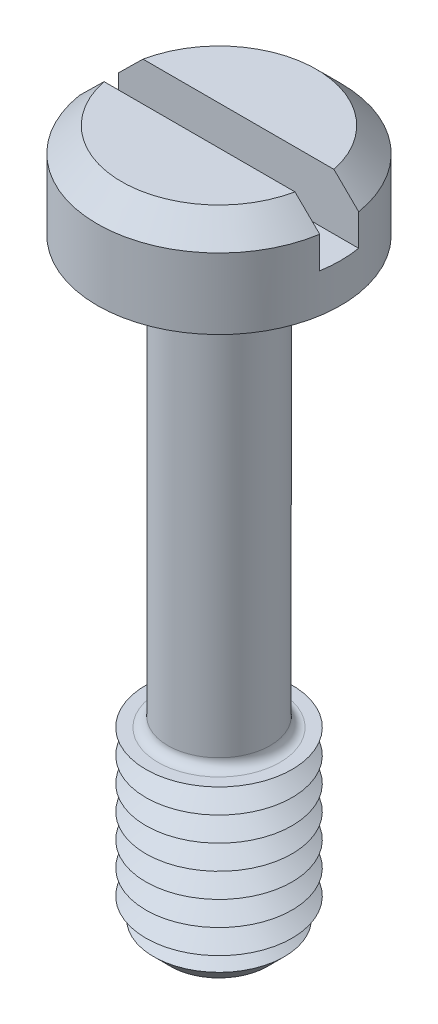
SolidWorks part; units mm, degrees
ref_plane "Front Plane" through (0, 0, 0) normal (0, 0, 1) x (1, 0, 0)
ref_plane "Top Plane" through (0, 0, 0) normal (0, 1, 0) x (1, 0, 0)
ref_plane "Right Plane" through (0, 0, 0) normal (1, 0, 0) x (0, 0, -1)
sketch "Sketch1" plane through (0, 0, 0) normal (0, 1, 0) x (1, 0, 0)
  circle A0 centre (0, 0) radius 5
  dimension "D1" = 10
extrude "Boss-Extrude1" add sketch "Sketch1" along normal blind 3.9
sketch "Sketch2" plane through (0, 0, 0) normal (0, -1, 0) x (1, 0, 0)
  circle A0 centre (0, 0) radius 2.1
  dimension "D1" = 4.2
extrude "Boss-Extrude2" add sketch "Sketch2" along normal blind 25
sketch "Sketch3" plane through (0, -25, 0) normal (0, -1, 0) x (1, 0, 0)
  circle A0 centre (0, 0) radius 3
  dimension "D1" = 6
extrude "Boss-Extrude3" add sketch "Sketch3" against normal blind 7.5
chamfer "Chamfer1" distance 1 angle 45 1 edges at (0, -25, -3)
sketch "Sketch4" plane through (0, 0, 0) normal (1, 0, 0) x (0, 0, -1)
  line L0 (0, -6.5871) -> (0, -12.0372) construction
sketch "Sketch5" plane through (0, 0, 0) normal (1, 0, 0) x (0, 0, -1)
  line L0 (-3, -17.5) -> (-2.134, -18)
  line L1 (-2.134, -18) -> (-3, -18.5)
  line L2 (-3, -17.5) -> (-3, -24) construction
  line L3 (-3, -18.5) -> (-3, -17.5)
  dimension "D1" = 1
revolve "Cut-Revolve1" cut sketch "Sketch5" angle 360 about L0
pattern_linear "LPattern1" count 7 spacing 1 along (0, -1, 0) of "Cut-Revolve1"
fillet "Fillet1" radius 0.4 2 edges at (0, -17.5, -2.1) (0, 0, -2.1)
chamfer "Chamfer2" distance 1 angle 45 1 edges at (0, 3.9, 5)
sketch "Sketch6" plane through (0, 3.9, 0) normal (0, 1, 0) x (1, 0, 0)
  line L1 (5, -0.8) -> (-5, -0.8)
  line L2 (5, -0.8) -> (5, 0.8)
  line L3 (5, 0.8) -> (-5, 0.8)
  line L4 (-5, -0.8) -> (-5, 0.8)
  line L5 (5, -0.8) -> (-5, 0.8) construction
  line L6 (5, 0.8) -> (-5, -0.8) construction
  circle A0 centre (0, 0) radius 5 construction
  point P0 (0, 0)
  dimension "D1" = 1.6
extrude "Cut-Extrude1" cut sketch "Sketch6" against normal blind 2.3
